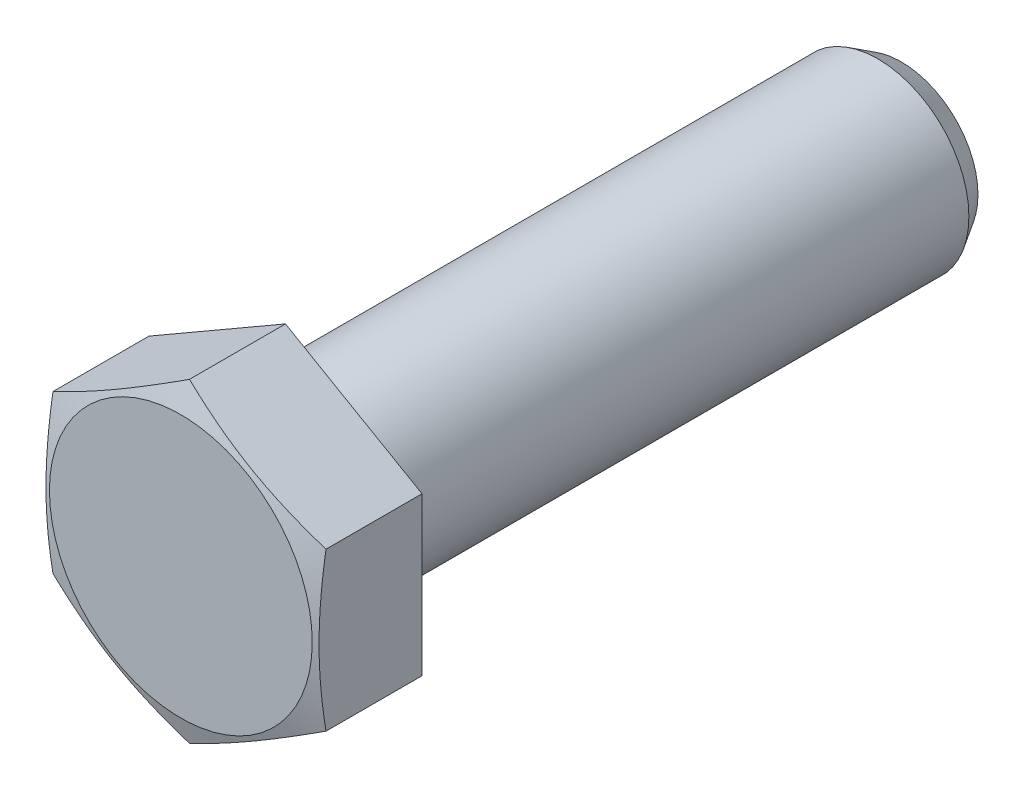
SolidWorks part; units mm, degrees
ref_plane "Plan1" through (0, 0, 0) normal (0, 0, 1) x (1, 0, 0)
ref_plane "Plan2" through (0, 0, 0) normal (0, 1, 0) x (1, 0, 0)
ref_plane "Plan3" through (0, 0, 0) normal (1, 0, 0) x (0, 0, -1)
imported_body "Vis H M12-40 - 4,6, Grade A, type 2 - NF E 25-114"
sketch "Esquisse1" plane through (0, 0, -3.6) normal (0, 0, 1) x (1, 0, 0)
  circle A0 centre (0, 0) radius 6 construction
  circle A1 centre (0, 0) radius 6
extrude "Boss.-Extru.1" add sketch "Esquisse1" along normal up to next
